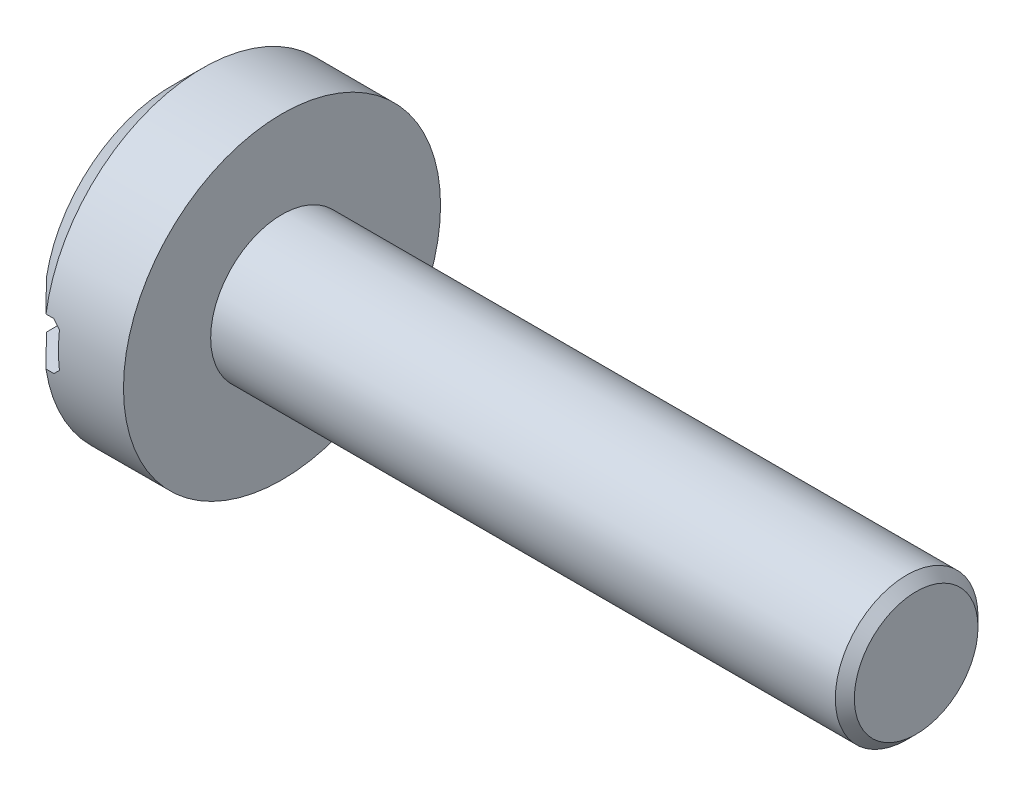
SolidWorks part; units mm, degrees
ref_plane "Face" through (0, 0, 0) normal (0, 0, 1) x (1, 0, 0)
ref_plane "Dessus" through (0, 0, 0) normal (0, 1, 0) x (1, 0, 0)
ref_plane "Droite" through (0, 0, 0) normal (1, 0, 0) x (0, 0, -1)
sketch "Esquisse1" plane through (0, 0, 0) normal (0, 0, 1) x (1, 0, 0)
  line L0 (0, 0) -> (0, 4)
  line L1 (1, 5) -> (3.5, 5)
  line L2 (3.5, 5) -> (3.5, 0)
  line L5 (0, 0) -> (7.6423, 0) construction
  line L7 (0, 4) -> (1, 5)
  line L8 (0, 0) -> (3.5, 0)
  point P1 (0, 5)
  dimension "D1" = 5
  dimension "D3" = 3.5
  dimension "D9" = 1
revolve "Révolution1" add sketch "Esquisse1" angle 360 about L5
sketch "Esquisse2" plane through (0, 0, 0) normal (0, 0, 1) x (1, 0, 0)
  line L0 (0, 4) -> (0, -4) construction
  line L1 (0, 0.75) -> (1.25, 0.75)
  line L2 (0, 0.75) -> (0, -0.75)
  line L3 (0, -0.75) -> (1.25, -0.75)
  line L4 (1.45, 0.55) -> (1.45, -0.55)
  line L5 (1.25, 0.75) -> (1.45, 0.55)
  line L6 (1.25, -0.75) -> (1.45, -0.55)
  point P1 (1.45, -0.75)
  point P3 (1.45, 0.75)
  dimension "D3" = 0.2
  dimension "D4" = 0.2
  dimension "D1" = 1.5
  dimension "D2" = 1.25
extrude "Enlèv. mat.-Extru.1" cut sketch "Esquisse2" against normal mid plane 10
sketch "Esquisse3" plane through (3.5, 0, 0) normal (1, 0, 0) x (0, 0, -1)
  circle A0 centre (0, 0) radius 2.25
  dimension "D1" = 4.5
extrude "Extrusion1" add sketch "Esquisse3" along normal blind 20
chamfer "Chanfrein1" distance 0.3 angle 45 1 edges at (23.5, 0, -2.25)
